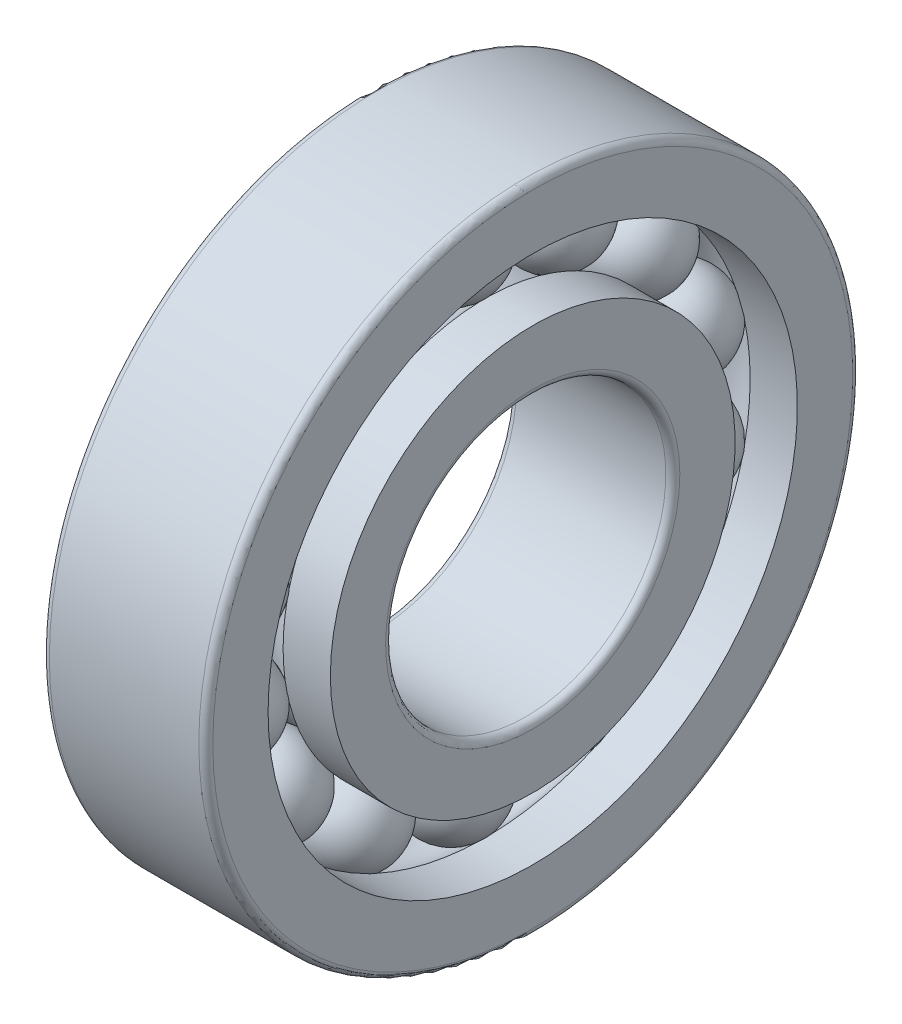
SolidWorks part; units mm, degrees
ref_plane "Front" through (0, 0, 0) normal (0, 0, 1) x (1, 0, 0)
ref_plane "Top" through (0, 0, 0) normal (0, 1, 0) x (1, 0, 0)
ref_plane "Right" through (0, 0, 0) normal (1, 0, 0) x (0, 0, -1)
sketch "Sketch1" plane through (0, 0, 0) normal (0, 0, 1) x (1, 0, 0)
  line L0 (-9.6833, 0) -> (9.8371, 0) construction
  line L1 (-2, 10) -> (2, 10)
  line L2 (-4.5966, 10) -> (4.6657, 10) construction
  arc A0 (2, 10) -> (-2, 10) centre (0, 10) ccw
  dimension "dia" = 4
  dimension "d0" = 20
revolve "Revolve1" add sketch "Sketch1" angle 360 about L2
sketch "Sketch2" plane through (0, 0, 0) normal (0, 0, 1) x (1, 0, 0)
  line L0 (-3.5, 8.6667) -> (-3.5, 6)
  line L1 (-3.5, 6) -> (3.5, 6)
  line L2 (3.5, 6) -> (3.5, 8.6667)
  line L3 (3.5, 8.6667) -> (1.4773, 8.6667)
  line L4 (-6.9714, 0) -> (8.1665, 0) construction
  line L5 (-6.7058, 10) -> (6.7058, 10) construction
  line L6 (-1.4773, 8.6667) -> (-3.5, 8.6667)
  arc A0 (-1.4773, 8.6667) -> (1.4773, 8.6667) centre (0, 10) ccw
  dimension "D5" = 3.98
  dimension "B" = 7
  dimension "B/2" = 3.5
  dimension "D3" = 10
  dimension "d" = 12
  dimension "D4" = 2.6667
revolve "Revolve2" add sketch "Sketch2" angle 360 about L4
sketch "Sketch3" plane through (0, 0, 0) normal (0, 0, 1) x (1, 0, 0)
  line L0 (-8.7107, 0) -> (9.1288, 0) construction
  line L1 (-3.5, 14) -> (3.5, 14)
  line L2 (-3.5, 14) -> (-3.5, 11.3333)
  line L3 (-3.5, 11.3333) -> (-1.4773, 11.3333)
  line L4 (3.5, 14) -> (3.5, 11.3333)
  line L5 (-7.2948, 10) -> (7.2948, 10) construction
  line L6 (1.4773, 11.3333) -> (3.5, 11.3333)
  arc A0 (1.4773, 11.3333) -> (-1.4773, 11.3333) centre (0, 10) ccw
  dimension "D1" = 3.98
  dimension "DD" = 28
  dimension "B" = 7
  dimension "B/2" = 3.5
  dimension "D4" = 10
  dimension "D5" = 2.6667
revolve "Revolve3" add sketch "Sketch3" angle 360 about L0
pattern_circular "Circular-Pattern1" count 14 over 360 about axis through (0, 0, 0) along (1, 0, 0) of "Revolve1"
fillet "Fillet1" radius 0.3 4 edges at (-3.5, 0, 6) (-3.5, 0, 14) (3.5, 0, 14) (3.5, 0, 6)
equation "\"d0@Sketch1\" = ( \"DD@Sketch3\" + \"d@Sketch2\" )  / 2"
equation "\"dia@Sketch1\" =  ( \"DD@Sketch3\" - \"d@Sketch2\" )  / 4"
equation "\"D3@Sketch2\" = ( \"DD@Sketch3\" + \"d@Sketch2\" )  / 2 / 2"
equation "\"D4@Sketch2\" = ( \"DD@Sketch3\" - \"d@Sketch2\" )  / 6"
equation "\"D5@Sketch2\" = \"dia@Sketch1\" - 0.02"
equation "\"B/2@Sketch2\" = \"B@Sketch2\" / 2"
equation "\"D4@Sketch3\" = ( \"DD@Sketch3\" + \"d@Sketch2\" )  / 2 / 2"
equation "\"D5@Sketch3\" = ( \"DD@Sketch3\" - \"d@Sketch2\" )  / 6"
equation "\"B@Sketch3\" = \"B@Sketch2\""
equation "\"B/2@Sketch3\" = \"B@Sketch3\" / 2"
equation "\"D1@Sketch3\" = \"dia@Sketch1\" - 0.02"
equation "\"m@Circular-Pattern1\" = int( 3.14159265 / atn(( \"dia@Sketch1\" / 2) / sqr(( \"DD@Sketch3\" + \"d@Sketch2\" )  / 2 * ( \"DD@Sketch3\" + \"d@Sketch2\" )  / 2/4 - ( \"dia@Sketch1\" / 2) *  ( \"dia@Sketch1\" / 2))))-1"
